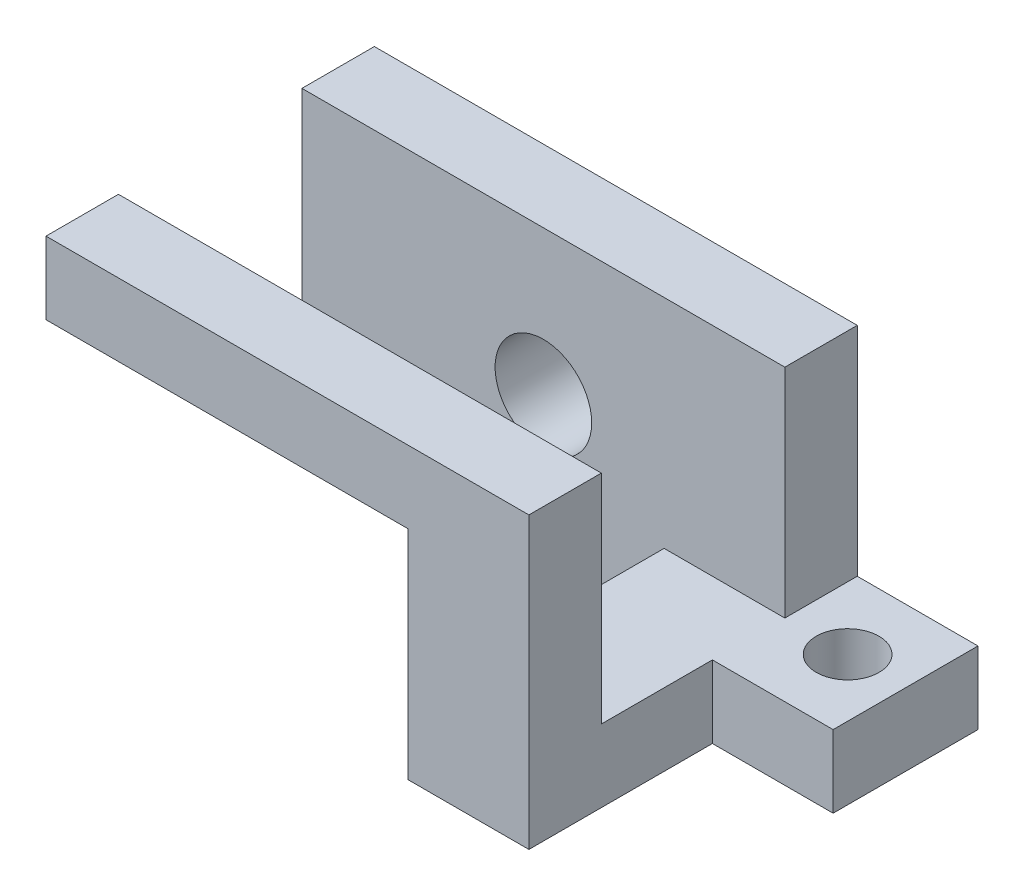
SolidWorks part; units mm, degrees
ref_plane "Front Plane" through (0, 0, 0) normal (0, 0, 1) x (1, 0, 0)
ref_plane "Top Plane" through (0, 0, 0) normal (0, 1, 0) x (1, 0, 0)
ref_plane "Right Plane" through (0, 0, 0) normal (1, 0, 0) x (0, 0, -1)
sketch "Sketch1" plane through (0, 0, 0) normal (0, 0, 1) x (1, 0, 0)
  line L1 (-50, -30) -> (50, -30)
  line L2 (-50, -30) -> (-50, 30)
  line L3 (-50, 30) -> (50, 30)
  line L4 (50, -30) -> (50, 30)
  line L5 (-50, -30) -> (50, 30) construction
  line L6 (-50, 30) -> (50, -30) construction
  circle A0 centre (0, 0) radius 10
  point P0 (0, 0)
  dimension "D3" = 20
  dimension "D1" = 100
  dimension "D2" = 60
extrude "Boss-Extrude1" add sketch "Sketch1" against normal blind 15
sketch "Sketch2" plane through (0, 0, 0) normal (0, 0, 1) x (1, 0, 0)
  line L1 (50, -30) -> (25, -30)
  line L2 (50, -30) -> (50, -15)
  line L3 (50, -15) -> (25, -15)
  line L4 (25, -30) -> (25, -15)
  dimension "D1" = 15
  dimension "D2" = 25
extrude "Boss-Extrude2" add sketch "Sketch2" along normal blind 53
sketch "Sketch3" plane through (0, -15, 0) normal (0, 1, 0) x (1, 0, 0)
  line L0 (25, -53) -> (25, 0) construction
  line L1 (50, -53) -> (25, -53)
  line L2 (50, -53) -> (50, -38)
  line L3 (50, -38) -> (25, -38)
  line L4 (25, -53) -> (25, -38)
  dimension "D1" = 15
extrude "Boss-Extrude3" add sketch "Sketch3" along normal blind 45
sketch "Sketch4" plane through (25, 0, 0) normal (-1, 0, 0) x (0, 0, 1)
  line L0 (53, 30) -> (53, -30) construction
  line L1 (38, 30) -> (53, 30)
  line L2 (38, 30) -> (38, 15)
  line L3 (38, 15) -> (53, 15)
  line L4 (53, 30) -> (53, 15)
  dimension "D1" = 15
extrude "Boss-Extrude4" add sketch "Sketch4" along normal blind 75
sketch "Sketch5" plane through (50, 0, 0) normal (1, 0, 0) x (0, 0, -1)
  line L0 (-38, -15) -> (0, -15) construction
  line L1 (15, -30) -> (-15, -30)
  line L2 (15, -30) -> (15, -15)
  line L3 (15, -15) -> (-15, -15)
  line L4 (-15, -30) -> (-15, -15)
  dimension "D1" = 30
extrude "Boss-Extrude6" add sketch "Sketch5" along normal blind 25
sketch "Sketch7" plane through (0, -15, 0) normal (0, 1, 0) x (1, 0, 0)
  line L0 (75, 15) -> (75, -15) construction
  circle A0 centre (63, 0) radius 6.5
  point P4 (75, 0)
  dimension "D1" = 13
  dimension "D2" = 12
extrude "Cut-Extrude2" cut sketch "Sketch7" against normal through all
